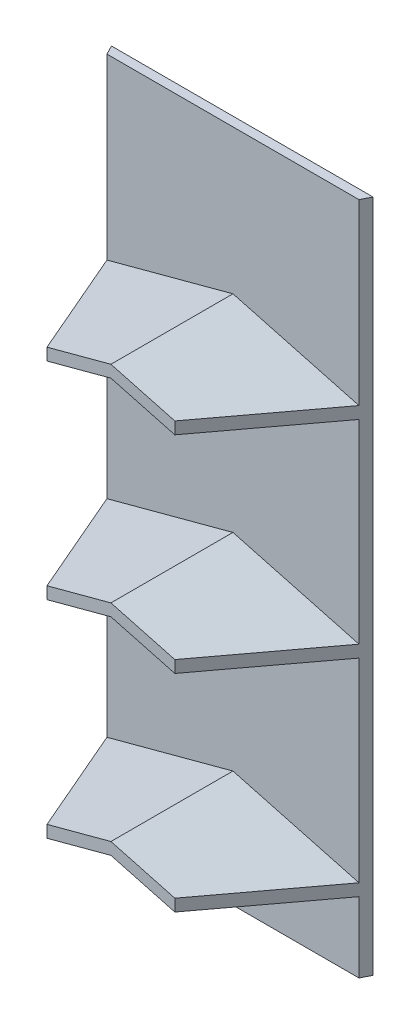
SolidWorks part; units mm, degrees
ref_plane "Front Plane" through (0, 0, 0) normal (0, 0, 1) x (1, 0, 0)
ref_plane "Top Plane" through (0, 0, 0) normal (0, 1, 0) x (1, 0, 0)
ref_plane "Right Plane" through (0, 0, 0) normal (1, 0, 0) x (0, 0, -1)
sketch "Sketch1" plane through (0, 0, 0) normal (0, 0, 1) x (1, 0, 0)
  line L0 (-28.575, -0.0142) -> (-28.575, 115.9858)
  line L1 (-28.575, -0.0142) -> (28.575, -0.0142)
  line L3 (-28.575, 115.9858) -> (28.575, 115.9858)
  line L4 (28.575, -0.0142) -> (28.575, 115.9858)
  point P18 (0, 18.5528)
  dimension "D1" = 116
extrude "Boss-Extrude1" add sketch "Sketch1" along normal blind 1.6
sketch "Sketch2" plane through (0, 0, 1.6) normal (0, 0, 1) x (1, 0, 0)
  line L0 (0, 115.9858) -> (0, -0.0142) construction
  line L1 (28.575, 115.9858) -> (-28.575, 115.9858) construction
  line L2 (-28.575, -0.0142) -> (28.575, -0.0142) construction
  line L3 (-39.2667, 19.9858) -> (54.9734, 19.9858) construction
  line L4 (0, 19.9858) -> (38.9067, 9.5608)
  line L5 (0.002, 17.9147) -> (38.8281, 7.5113)
  line L6 (38.9067, 9.5608) -> (38.8281, 7.5113)
  line L7 (0.002, 17.9147) -> (-38.8281, 7.5113)
  line L8 (0, 19.9858) -> (-38.9067, 9.5608)
  line L9 (-38.9067, 9.5608) -> (-38.8281, 7.5113)
  line L10 (0, 55.5458) -> (38.9067, 45.1208)
  line L11 (0.002, 53.4747) -> (38.8281, 43.0713)
  line L12 (38.9067, 45.1208) -> (38.8281, 43.0713)
  line L13 (0.002, 53.4747) -> (-38.8281, 43.0713)
  line L14 (0, 55.5458) -> (-38.9067, 45.1208)
  line L15 (-38.9067, 45.1208) -> (-38.8281, 43.0713)
  line L16 (0, 91.1058) -> (38.9067, 80.6808)
  line L17 (0.002, 89.0347) -> (38.8281, 78.6313)
  line L18 (38.9067, 80.6808) -> (38.8281, 78.6313)
  line L19 (0.002, 89.0347) -> (-38.8281, 78.6313)
  line L20 (0, 91.1058) -> (-38.9067, 80.6808)
  line L21 (-38.9067, 80.6808) -> (-38.8281, 78.6313)
  dimension "D1" = 20
  dimension "D2" = 15
  dimension "D3" = 2
  dimension "D4" = 3
extrude "Boss-Extrude2" add sketch "Sketch2" along normal blind 25
sketch "Sketch3" plane through (0, 0, 0) normal (0, 1, 0) x (1, 0, 0)
  line L0 (-22.5, 0) -> (22.5, 0)
  line L1 (28.575, 0) -> (-28.575, 0) construction
  line L2 (-11, -22.6) -> (11, -22.6)
  line L3 (0, -26.6) -> (0, -1.6) construction
  line L4 (22.5, 0) -> (11, -22.6)
  line L5 (-22.5, 0) -> (-11, -22.6)
  point P10 (0, -22.6)
  point P11 (0, 0)
  dimension "D1" = 22.5
  dimension "D2" = 11
  dimension "D3" = 22.6
extrude "Cut-Extrude1" cut sketch "Sketch3" along normal through all and the other way through all flip side to cut
